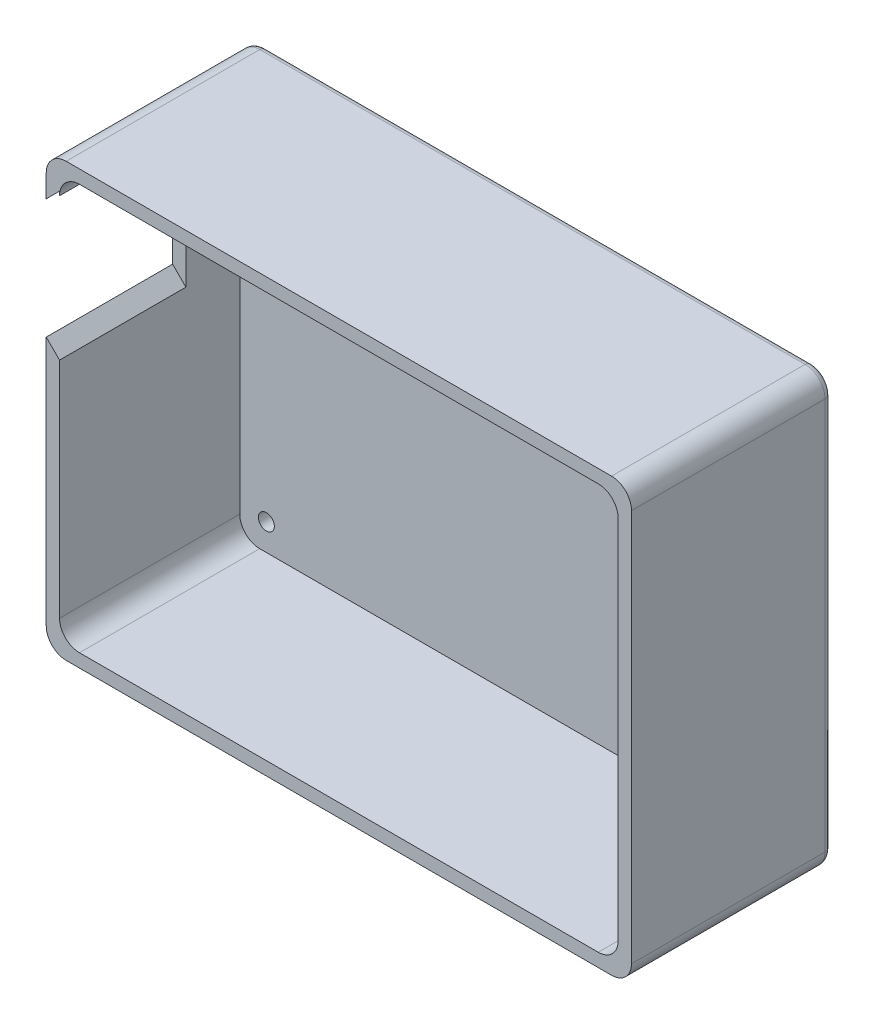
SolidWorks part; units mm, degrees
ref_plane "Front Plane" through (0, 0, 0) normal (0, 0, 1) x (1, 0, 0)
ref_plane "Top Plane" through (0, 0, 0) normal (0, 1, 0) x (1, 0, 0)
ref_plane "Right Plane" through (0, 0, 0) normal (1, 0, 0) x (0, 0, -1)
sketch "Base Footprint" plane through (0, 0, 0) normal (0, 0, 1) x (1, 0, 0)
  line L1 (3, 0) -> (79, 0)
  line L2 (0, 3) -> (0, 56)
  line L3 (3, 59) -> (79, 59)
  line L4 (82, 3) -> (82, 56)
  arc A0 (3, 0) -> (0, 3) centre (3, 3) cw
  arc A1 (79, 0) -> (82, 3) centre (79, 3) ccw
  arc A2 (79, 59) -> (82, 56) centre (79, 56) cw
  arc A3 (0, 56) -> (3, 59) centre (3, 56) cw
  point P7 (0, 0)
  dimension "D1" = 3
extrude "Extrude Base" add sketch "Base Footprint" along normal blind 3
sketch "Extended Base Footprint" plane through (0, 0, 0) normal (0, 0, -1) x (-1, 0, 0)
  line L9 (-82, 62) -> (0, 62)
  line L10 (-85, 59) -> (-85, 0)
  line L11 (-82, -3) -> (0, -3)
  line L12 (3, 59) -> (3, 0)
  arc A0 (-85, 0) -> (-82, -3) centre (-82, 0) ccw
  arc A1 (0, -3) -> (3, 0) centre (0, 0) ccw
  arc A2 (0, 62) -> (3, 59) centre (0, 59) cw
  arc A3 (-82, 62) -> (-85, 59) centre (-82, 59) ccw
  dimension "D1" = 3
extrude "Extend Base" add sketch "Extended Base Footprint" against normal blind 3
hole_wizard "CSK for M2 Flat Head Machine Screw1" positions "Sketch3" profile "Sketch4" countersink size "M2" standard "ANSI Metric"
sketch "Sketch3" plane through (0, 0, 0) normal (0, 0, -1) x (-1, 0, 0)
  point P0 (-79, 56)
  point P6 (-3, 56)
  point P10 (-3, 3)
  point P13 (-79, 3)
sketch "Sketch4" plane through (79, 56, 0) normal (1, 0, 0) x (0, 1, 0)
  line L0 (0, 0) -> (0, 3)
  line L1 (0, 3) -> (1.2, 3)
  line L2 (1.2, 3) -> (1.2, 1)
  line L3 (1.2, 1) -> (2.2, 0)
  line L5 (2.2, 0) -> (0, 0)
  line L6 (-1.2, 1) -> (-2.2, 0) construction
  line L11 (0, -6.35) -> (0, 107.95) construction
  dimension "Thru Hole Dia." = 2.4
  dimension "Thru Hole Depth" = 3
  dimension "Near C'Sink Dia." = 4.4
  dimension "Near C'Sink Angle" = 90
sketch "Screw Alignment" [suppressed] plane through (0, 0, 0) normal (0, 0, 1) x (1, 0, 0)
  line L3 (87.5922, 56) -> (-7.0088, 56)
  line L4 (79, -5.6913) -> (79, 62.6154)
  line L5 (85.6914, 3) -> (-5.8014, 3)
  line L6 (3, 62.6154) -> (3, -5.6913)
fillet "Smooth the top" radius 1 8 edges at (-2.1213, 61.1213, 0) (-3, 29.5, 0) (-2.1213, -2.1213, 0) (41, -3, 0) (84.1213, -2.1213, 0) (85, 29.5, 0) (84.1213, 61.1213, 0) (41, 62, 0)
sketch "Wall Outline" plane through (0, 0, 3) normal (0, 0, 1) x (1, 0, 0)
  line L1 (82, -3) -> (0, -3)
  line L2 (85, 0) -> (85, 59)
  line L3 (82, 62) -> (0, 62)
  line L4 (-3, 0) -> (-3, 59)
  line L9 (80, -1) -> (2, -1)
  line L10 (83, 2) -> (83, 57)
  line L11 (80, 60) -> (2, 60)
  line L12 (-1, 2) -> (-1, 57)
  arc A0 (85, 59) -> (82, 62) centre (82, 59) ccw
  arc A1 (83, 57) -> (80, 60) centre (80, 57) ccw
  arc A2 (0, 62) -> (-3, 59) centre (0, 59) ccw
  arc A3 (2, 60) -> (-1, 57) centre (2, 57) ccw
  arc A4 (2, -1) -> (-1, 2) centre (2, 2) cw
  arc A5 (0, -3) -> (-3, 0) centre (0, 0) cw
  arc A6 (80, -1) -> (83, 2) centre (80, 2) ccw
  arc A7 (82, -3) -> (85, 0) centre (82, 0) ccw
  dimension "D1" = 3
extrude "Build the wall" add sketch "Wall Outline" along normal blind 27.1
sketch "Wire Escape Footprint" plane through (0, 0, 30.1) normal (0, 0, 1) x (1, 0, 0)
  line L0 (-3, 55.605) -> (-3, 37.605)
  line L1 (-3, 59) -> (-3, 0) construction
  line L2 (-1, 35.605) -> (-3, 37.605)
  line L3 (-1, 57) -> (-1, 2) construction
  line L4 (-3, 55.605) -> (-1, 57.605)
  line L5 (-1, 35.605) -> (-1, 57.605)
extrude "Wire Escape" cut sketch "Wire Escape Footprint" against normal blind 19
